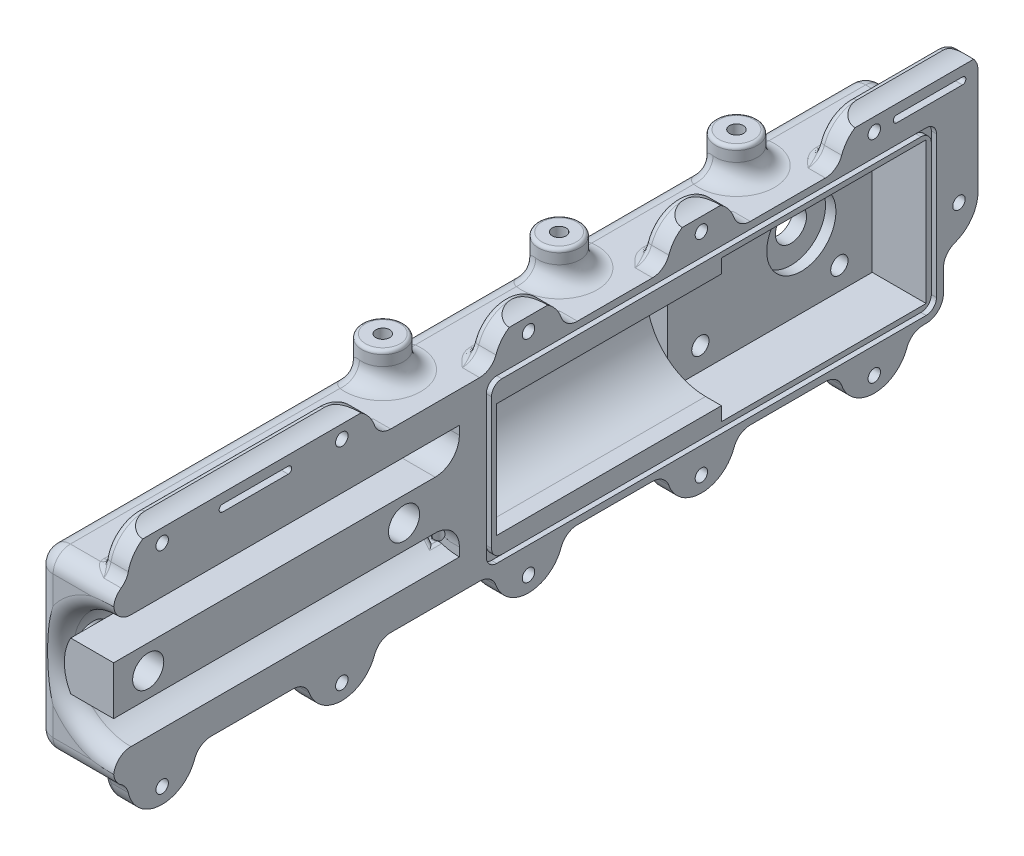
SolidWorks part; units mm, degrees
ref_plane "Plan de face" through (0, 0, 0) normal (0, 0, 1) x (1, 0, 0)
ref_plane "Plan de dessus" through (0, 0, 0) normal (0, 1, 0) x (1, 0, 0)
ref_plane "Plan de droite" through (0, 0, 0) normal (1, 0, 0) x (0, 0, -1)
sketch "Esquisse1" plane through (0, 0, 0) normal (1, 0, 0) x (0, 0, -1)
  line L5 (0, 0) -> (-240, 0)
  line L6 (0, 0) -> (0, 51)
  line L7 (0, 51) -> (-240, 51)
  line L8 (-240, 0) -> (-240, 51)
  dimension "D3" = 51
  dimension "D4" = 240
extrude "Boss.-Extru.2" add sketch "Esquisse1" along normal blind 22.5
sketch "Esquisse2" plane through (0, 0, 0) normal (-1, 0, 0) x (0, 0, 1)
  line L0 (0, 0) -> (0, 51) construction
  line L1 (5, 46) -> (64.2, 46)
  line L2 (5, 46) -> (5, 5)
  line L3 (5, 5) -> (64.2, 5)
  line L4 (64.2, 46) -> (64.2, 5)
  point P6 (5, 25.5)
  point P7 (0, 25.5)
  dimension "D1" = 41
  dimension "D2" = 59.2
  dimension "D3" = 5
extrude "Enlèv. mat.-Extru.1" cut sketch "Esquisse2" against normal blind 15.6
sketch "Esquisse3" plane through (0, 0, 0) normal (-1, 0, 0) x (0, 0, 1)
  line L0 (64.2, 5) -> (64.2, 46) construction
  line L1 (129.2, 42) -> (64.2, 42)
  line L2 (129.2, 42) -> (129.2, 9)
  line L3 (129.2, 9) -> (64.2, 9)
  line L4 (64.2, 42) -> (64.2, 9)
  point P7 (64.2, 25.5)
  point P8 (64.2, 25.5)
  dimension "D1" = 33
  dimension "D2" = 65
extrude "Enlèv. mat.-Extru.2" cut sketch "Esquisse3" against normal blind 21.6
fillet "Congé1" radius 17 2 edges at (21.6, 9, 96.7) (21.6, 42, 96.7)
sketch "Esquisse4" plane through (15.6, 0, 0) normal (-1, 0, 0) x (0, 0, 1)
  line L0 (5, 46) -> (5, 5) construction
  line L1 (64.2, 46) -> (5, 46) construction
  circle A0 centre (14.5, 39.5) radius 2.5
  circle A1 centre (54.7, 39.5) radius 2.5
  circle A2 centre (54.7, 11.5) radius 2.5
  circle A3 centre (14.5, 11.5) radius 2.5
  dimension "D3" = 5
  dimension "D1" = 40.2
  dimension "D2" = 28
  dimension "D4" = 9.5
  dimension "D5" = 6.5
extrude "Enlèv. mat.-Extru.4" cut sketch "Esquisse4" against normal through all
sketch "Esquisse5" plane through (15.6, 0, 0) normal (-1, 0, 0) x (0, 0, 1)
  line L0 (5, 46) -> (5, 5) construction
  line L1 (5, 46) -> (5, 5) construction
  circle A0 centre (25.5, 25.5) radius 10
  point P7 (5, 25.5)
  dimension "D1" = 20
  dimension "D2" = 20.5
extrude "Enlèv. mat.-Extru.5" cut sketch "Esquisse5" against normal blind 3
sketch "Esquisse6" plane through (18.6, 0, 0) normal (-1, 0, 0) x (0, 0, 1)
  circle A0 centre (25.5, 25.5) radius 4.5
  circle A1 centre (25.5, 25.5) radius 10 construction
  dimension "D1" = 9
extrude "Enlèv. mat.-Extru.6" cut sketch "Esquisse6" against normal through all
sketch "Esquisse7" plane through (0, 0, 240) normal (0, 0, 1) x (1, 0, 0)
  line L0 (0, 51) -> (0, 0) construction
  circle A0 centre (0, 25.5) radius 14.25
  circle A1 centre (0, 25.5) radius 16.5
  dimension "D1" = 28.5
  dimension "D2" = 33
extrude "Enlèv. mat.-Extru.7" cut sketch "Esquisse7" against normal blind 100
sketch "Esquisse8" plane through (22.5, 0, 0) normal (1, 0, 0) x (0, 0, -1)
  line L0 (-240, 51) -> (-240, 0) construction
  circle A0 centre (-230, 25.5) radius 4.5
  circle A1 centre (-156, 25.5) radius 4.5
  point P7 (-240, 25.5)
  dimension "D1" = 9
  dimension "D2" = 74
  dimension "D3" = 10
extrude "Enlèv. mat.-Extru.8" cut sketch "Esquisse8" against normal through all
sketch "Esquisse9" plane through (0, 0, 240) normal (0, 0, 1) x (1, 0, 0)
  line L0 (-0.9801, 40.4) -> (-0.9801, 32.5)
  line L1 (-0.9801, 32.5) -> (13.7913, 32.5)
  line L2 (-0.9801, 10.6) -> (-0.9801, 18.5)
  line L4 (-0.9801, 18.5) -> (13.7913, 18.5)
  spline S0 degree 3 poles (-0.9801, 40.4) (1.9842, 40.2871) (8.4104, 40.1159) (12.8329, 35.266) (13.7913, 32.5) knots 0 0 0 0 0.512203 1 1 1 1
  spline S2 degree 3 poles (-0.9801, 10.6) (1.902, 10.0791) (8.428, 10.7944) (12.2618, 16.0303) (13.7913, 18.5) knots 0 0 0 0 0.497728 1 1 1 1
  dimension "D3" = 1.6
  dimension "D1" = 14
  dimension "D2" = 1.6
extrude "Enlèv. mat.-Extru.9" cut sketch "Esquisse9" against normal up to surface (100 mm away)
fillet "Congé2" radius 7 2 edges at (6.2061, 18.5, 140) (6.2061, 32.5, 140)
sketch "Esquisse10" plane through (0, 0, 0) normal (-1, 0, 0) x (0, 0, 1)
  line L0 (0, 0) -> (0, 51) construction
  line L1 (0, 51) -> (240, 51) construction
  line L2 (240, 0) -> (0, 0) construction
  line L3 (0, 35.5) -> (0, 15.5)
  line L4 (10, 51) -> (30, 51)
  line L5 (110, 51) -> (130, 51)
  line L6 (216, 51) -> (236, 51)
  line L7 (236, 0) -> (216, 0)
  line L8 (130, 0) -> (110, 0)
  line L9 (30, 0) -> (10, 0)
  line L10 (60, 51) -> (80, 51)
  line L11 (60, 0) -> (80, 0)
  line L12 (164, 0) -> (184, 0)
  line L13 (164, 51) -> (184, 51)
  arc A0 (0, 35.5) -> (0, 15.5) centre (0, 25.5) ccw
  arc A1 (130, 51) -> (110, 51) centre (120, 51) ccw
  arc A2 (130, 0) -> (110, 0) centre (120, 0) cw
  arc A3 (30, 51) -> (10, 51) centre (20, 51) ccw
  arc A4 (30, 0) -> (10, 0) centre (20, 0) cw
  arc A5 (236, 51) -> (216, 51) centre (226, 51) ccw
  arc A6 (236, 0) -> (216, 0) centre (226, 0) cw
  arc A7 (80, 51) -> (60, 51) centre (70, 51) ccw
  arc A8 (80, 0) -> (60, 0) centre (70, 0) cw
  arc A9 (184, 51) -> (164, 51) centre (174, 51) ccw
  arc A10 (184, 0) -> (164, 0) centre (174, 0) cw
  dimension "D5" = 10
  dimension "D1" = 100
  dimension "D2" = 106
  dimension "D3" = 50
  dimension "D4" = 54
extrude "Boss.-Extru.3" add sketch "Esquisse10" against normal blind 7
fillet "Congé3" radius 5 31 edges at (11.25, 51, 240) (22.5, 25.5, 240) (11.25, 0, 240) (16.5, 25.5, 240) (3.5, 0, 130) (3.5, 0, 110) (3.5, 0, 164) (3.5, 0, 184) (3.5, 0, 236) (3.5, 0, 216) (3.5, 0, 80) (3.5, 0, 60) (3.5, 0, 30) (3.5, 0, 10) (3.5, 51, 184) (3.5, 51, 164) (3.5, 51, 110) (3.5, 51, 130) (3.5, 51, 60) (3.5, 51, 80) (3.5, 51, 10) (3.5, 51, 30) (3.5, 51, 236) (3.5, 51, 216) (3.5, 35.5, 0) (3.5, 15.5, 0) (22.5, 0, 120) (11.25, 0, 0) (22.5, 51, 120) (22.5, 25.5, 0) (11.25, 51, 0)
fillet "Congé4" radius 5 2 edges at (3.5, 50.8991, 235.9995) (3.5, 0.1009, 235.9995)
fillet "Congé5" radius 2 28 edges at (7, 51.9175, 58.7446) (7, 51, 70) (7, 51.9175, 81.2554) (7, 61, 70) (7, 51.9175, 108.7446) (7, 51, 120) (7, 51.9175, 131.2554) (7, 61, 120) (7, -0.4534, 236.5017) (7, 0, 223.4289) (7, -0.9175, 214.7446) (7, -9.9817, 226.6047) (7, -0.9175, 185.2554) (7, 0, 174) (7, -0.9175, 162.7446) (7, -10, 174) (7, -0.9175, 131.2554) (7, 0, 120) (7, -0.9175, 108.7446) (7, -10, 120) (7, -0.9175, 81.2554) (7, 0, 70) (7, -0.9175, 58.7446) (7, -10, 70) (7, -0.9175, 31.2554) (7, 0, 20) (7, -0.9175, 8.7446) (7, -10, 20)
sketch "Esquisse11" plane through (22.5, 0, 0) normal (1, 0, 0) x (0, 0, -1)
  circle A0 centre (-54.7, 39.5) radius 5
  circle A1 centre (-14.5, 39.5) radius 5
  circle A2 centre (-14.5, 11.5) radius 5
  circle A3 centre (-54.7, 11.5) radius 5
  dimension "D1" = 10
extrude "Enlèv. mat.-Extru.10" cut sketch "Esquisse11" against normal blind 3
mirror "Symétrie1" about plane through (0, 0, 0) normal (1, 0, 0) of "Enlèv. mat.-Extru.10", "Congé5", "Congé4", "Congé3", "Boss.-Extru.3", "Congé2", "Enlèv. mat.-Extru.9", "Enlèv. mat.-Extru.8", "Enlèv. mat.-Extru.7", "Enlèv. mat.-Extru.6", "Enlèv. mat.-Extru.5", "Enlèv. mat.-Extru.4", "Congé1", "Enlèv. mat.-Extru.1", "Enlèv. mat.-Extru.2", "Boss.-Extru.2"
sketch "Esquisse12" plane through (0, 0, 0) normal (1, 0, 0) x (0, 0, -1)
  line L1 (-247.0268, 61.9911) -> (12.212, 61.9911)
  line L2 (-247.0268, 61.9911) -> (-247.0268, -12.2581)
  line L3 (-247.0268, -12.2581) -> (12.212, -12.2581)
  line L4 (12.212, 61.9911) -> (12.212, -12.2581)
extrude "Enlèv. mat.-Extru.11" cut sketch "Esquisse12" along normal blind 37
sketch "Esquisse13" plane through (-7, 0, 0) normal (-1, 0, 0) x (0, 0, 1)
  line L2 (27.8176, -2) -> (12.1824, -2) construction
  line L3 (62.1824, 53) -> (77.8176, 53) construction
  line L4 (112.1824, 53) -> (127.8176, 53) construction
  line L5 (5.8579, 51) -> (34.1421, 51) construction
  line L8 (0, 11.3579) -> (0, 39.6421) construction
  line L9 (181.8176, -2) -> (166.1824, -2) construction
  line L10 (233.746, -2) -> (218.1824, -2) construction
  circle A0 centre (225.9642, 55.5) radius 1.8
  circle A1 centre (174, 55.5) radius 1.8
  circle A2 centre (225.9642, -5.5) radius 1.8
  circle A3 centre (174, -5.5) radius 1.8
  circle A4 centre (120, -5.5) radius 1.8
  circle A5 centre (120, 55.5) radius 1.8
  circle A6 centre (70, 55.5) radius 1.8
  circle A7 centre (70, -5.5) radius 1.8
  circle A8 centre (20, -5.5) radius 1.8
  circle A9 centre (20, 55.5) radius 1.8
  circle A10 centre (-4.5, 25.5) radius 1.8
  point P37 (70, 53)
  point P41 (120, 53)
  point P45 (0, 25.5)
  point P54 (20, 51)
  point P63 (174, -2)
  point P68 (225.9642, -2)
  dimension "D1" = 3.6
  dimension "D2" = 4.5
  dimension "D3" = 4.5
  dimension "D4" = 3.5
extrude "Enlèv. mat.-Extru.12" cut sketch "Esquisse13" against normal blind 8
chamfer "Chanfrein1" distance 2.6 angle 45 11 edges at (-7, -5.5, 121.8) (-7, -5.5, 175.8) (-7, -5.5, 227.7642) (-7, 55.5, 227.7642) (-7, 55.5, 175.8) (-7, 55.5, 121.8) (-7, 55.5, 71.8) (-7, -5.5, 71.8) (-7, -5.5, 21.8) (-7, 25.5, -2.7) (-7, 55.5, 21.8)
sketch "Esquisse14" plane through (0, 0, 0) normal (1, 0, 0) x (0, 0, -1)
  line L0 (-5, 46) -> (-5, 5) construction
  line L1 (-6.5, 47.5) -> (-127.7, 47.5)
  line L2 (-3.5, 44.5) -> (-3.5, 6.5)
  line L3 (-6.5, 3.5) -> (-127.7, 3.5)
  line L4 (-130.7, 44.5) -> (-130.7, 6.5)
  line L5 (-5, 49) -> (-129.2, 49)
  line L6 (-2, 46) -> (-2, 5)
  line L7 (-5, 2) -> (-129.2, 2)
  line L8 (-132.2, 46) -> (-132.2, 5)
  line L9 (-64.2, 46) -> (-5, 46) construction
  line L10 (-5, 5) -> (-64.2, 5) construction
  line L11 (-129.2, 9) -> (-129.2, 42) construction
  arc A0 (-127.7, 47.5) -> (-130.7, 44.5) centre (-127.7, 44.5) ccw
  arc A1 (-129.2, 49) -> (-132.2, 46) centre (-129.2, 46) ccw
  arc A2 (-5, 49) -> (-2, 46) centre (-5, 46) cw
  arc A3 (-6.5, 47.5) -> (-3.5, 44.5) centre (-6.5, 44.5) cw
  arc A4 (-2, 5) -> (-5, 2) centre (-5, 5) cw
  arc A5 (-129.2, 2) -> (-132.2, 5) centre (-129.2, 5) cw
  arc A6 (-127.7, 3.5) -> (-130.7, 6.5) centre (-127.7, 6.5) cw
  arc A7 (-3.5, 6.5) -> (-6.5, 3.5) centre (-6.5, 6.5) cw
  dimension "D9" = 3
  dimension "D1" = 1.5
  dimension "D2" = 1.5
  dimension "D3" = 1.5
  dimension "D4" = 1.5
  dimension "D5" = 1.5
  dimension "D6" = 1.5
  dimension "D7" = 1.5
  dimension "D8" = 1.5
extrude "Enlèv. mat.-Extru.13" cut sketch "Esquisse14" against normal blind 1.5
sketch "Esquisse15" plane through (0, 0, 129.2) normal (0, 0, -1) x (-1, 0, 0)
  line L0 (0, 9) -> (0, 42) construction
  circle A0 centre (8, 13.4525) radius 4
  arc A1 (4.6, 9) -> (21.5926, 25.5) centre (4.6, 26) ccw construction
  dimension "D1" = 8
  dimension "D2" = 8
extrude "Enlèv. mat.-Extru.14" cut sketch "Esquisse15" against normal up to surface (14.1165 mm away)
sketch "Esquisse16" plane through (0, 0, 0) normal (0, -1, 0) x (1, 0, 0)
  line L0 (-8, 137.1421) -> (-5, 137.1421) construction
  line L1 (-8, 139.1421) -> (-5, 139.1421)
  line L2 (-8, 135.1421) -> (-5, 135.1421)
  line L3 (0, 159.8579) -> (0, 134.1421) construction
  line L4 (-5, 134.1421) -> (0, 134.1421) construction
  arc A0 (-8, 139.1421) -> (-8, 135.1421) centre (-8, 137.1421) ccw
  arc A1 (-5, 135.1421) -> (-5, 139.1421) centre (-5, 137.1421) ccw
  point P2 (-6.5, 137.1421)
  dimension "D1" = 4
  dimension "D2" = 3
  dimension "D3" = 5
  dimension "D4" = 3
extrude "Enlèv. mat.-Extru.15" cut sketch "Esquisse16" against normal blind 14
fillet "Congé7" radius 3 1 edges at (-8, 17.4525, 129.2)
fillet "Congé8" radius 1 5 edges at (-4.0269, 12.9896, 138.8894) (-6.3542, 9.8067, 139.1421) (-4.4338, 11.6408, 135.2239) (-9.9958, 9.986, 137.0125) (-6.3542, 9.8067, 135.1421)
fillet "Congé9" radius 2 1 edges at (-9.4073, 11.9445, 140.0141)
fillet "Congé10" radius 2 5 edges at (-11.9445, 14.1167, 141.0777) (-11.5617, 15.273, 140) (-5.8575, 10.0747, 141.6907) (-11.2285, 11.091, 140.0441)
fillet "Congé12" radius 2 1 edges at (-10.8487, 16.2605, 139.934)
fillet "Congé13" radius 3 4 edges at (-3, 0, 137.1421) (-6.5, 0, 135.1421) (-10, 0, 137.1421) (-6.5, 0, 139.1421)
sketch "Esquisse17" plane through (0, 0, 0) normal (1, 0, 0) x (0, 0, -1)
  line L0 (-20, 61) -> (5, 61)
  line L1 (10, 56) -> (10, 25.5)
  line L2 (-226, 61) -> (-174, 61)
  line L4 (-186.6196, 50.2394) -> (-214.9858, 50.2394)
  arc A0 (-10.5719, 54.3333) -> (-29.4281, 54.3333) centre (-20, 51) ccw construction
  arc A1 (3.3333, 16.0719) -> (3.3333, 34.9281) centre (0, 25.5) ccw construction
  arc A2 (5, 61) -> (10, 56) centre (5, 56) cw
  arc A3 (-216.5719, 54.3333) -> (-235.7615, 53.1708) centre (-226, 51) ccw construction
  arc A4 (-164.5719, 54.3333) -> (-183.4281, 54.3333) centre (-174, 51) ccw construction
  spline S0 degree 3 poles (-20, 61) (-16.1428, 60.3069) (-13.4752, 55.9771) (-8.98, 49.1011) (-3.9795, 50.6024) (-1.1696, 48.1815) (-0.8201, 44.4832) (-1.0493, 40.3481) (-1.1061, 34.1768) (6.4652, 32.9411) (9.145, 28.4288) (10, 25.5) knots 0 0 0 0 0.195875 0.325509 0.406332 0.460765 0.518553 0.614083 0.720859 0.81792 1 1 1 1
  spline S1 degree 3 poles (-186.6196, 50.2394) (-184.2368, 50.739) (-182.9647, 53.5446) (-181.2911, 56.952) (-179.3207, 58.425) (-177.1202, 60.2541) (-174.6558, 59.8002) (-174, 61) knots 0 0 0 0 0.365291 0.514478 0.649539 0.78704 1 1 1 1
  spline S2 degree 3 poles (-214.9858, 50.2394) (-216.7319, 51.7727) (-217.2581, 55.0501) (-219.8033, 58.1898) (-222.3624, 60.3706) (-225.1716, 59.7078) (-226, 61) knots 0 0 0 0 0.407206 0.572661 0.743026 1 1 1 1
  dimension "D1" = 5
extrude "Boss.-Extru.5" add sketch "Esquisse17" against normal up to surface (7 mm away)
sketch "Esquisse18" plane through (0, 0, 0) normal (1, 0, 0) x (0, 0, -1)
  line L0 (-13.5, 55.5) -> (5.5, 55.5) construction
  line L1 (-13.5, 56.5) -> (5.5, 56.5)
  line L2 (-13.5, 54.5) -> (5.5, 54.5)
  line L3 (-208.5, 55.5) -> (-189.5, 55.5) construction
  line L4 (-208.5, 56.5) -> (-189.5, 56.5)
  line L5 (-208.5, 54.5) -> (-189.5, 54.5)
  line L6 (10, 25.5) -> (10, 56) construction
  line L7 (5, 61) -> (-20, 61) construction
  arc A0 (-13.5, 56.5) -> (-13.5, 54.5) centre (-13.5, 55.5) ccw
  arc A1 (5.5, 54.5) -> (5.5, 56.5) centre (5.5, 55.5) ccw
  arc A2 (-208.5, 56.5) -> (-208.5, 54.5) centre (-208.5, 55.5) ccw
  arc A3 (-189.5, 54.5) -> (-189.5, 56.5) centre (-189.5, 55.5) ccw
  circle A5 centre (-174, 55.5) radius 1.8 construction
  point P2 (-4, 55.5)
  point P7 (-199, 55.5)
  dimension "D1" = 2
  dimension "D2" = 19
  dimension "D3" = 2
  dimension "D4" = 19
  dimension "D5" = 4.5
  dimension "D6" = 5.5
  dimension "D7" = 25
extrude "Enlèv. mat.-Extru.16" cut sketch "Esquisse18" against normal blind 7
fillet "Congé14" radius 2 17 edges at (-7, 28.6789, 0) (-7, 51, 19.5711) (-7, 51, 197.4289) (-7, 59.165, 25.7735) (-7, 50.7771, 236.4764) (-7, 51.9175, 31.2554) (-7, 51.9175, 162.7446) (-7, 14.2446, -0.9175) (-7, 58.8009, 232.2567) (-7, 51.4534, 236.5017) (-7, 19.7265, -8.165) (-7, 49.5355, 1.4645) (-7, 61, 7.5) (-7, 59.5355, -8.5355) (-7, 40.75, -10) (-7, 59.165, 168.2265) (-7, 61, 200)
sketch "Esquisse19" plane through (0, 0, -10) normal (0, 0, -1) x (-1, 0, 0)
  circle A0 centre (0, 67.5622) radius 8.25
  dimension "D1" = 16.5
extrude "Enlèv. mat.-Extru.17" cut sketch "Esquisse19" against normal up to surface (250 mm away)
sketch "Esquisse20" plane through (0, 51, 0) normal (0, 1, 0) x (1, 0, 0)
  line L0 (0, -34.1421) -> (0, -55.8579) construction
  line L1 (-5, -55.8579) -> (0, -55.8579) construction
  line L2 (0, -134.1421) -> (-5, -134.1421) construction
  circle A0 centre (-16, -43.8579) radius 6
  circle A1 centre (-16, -95.1421) radius 6
  circle A2 centre (-16, -146.1421) radius 6
  dimension "D2" = 12
  dimension "D1" = 16
  dimension "D3" = 12
  dimension "D4" = 51
  dimension "D5" = 12
extrude "Boss.-Extru.6" add sketch "Esquisse20" along normal blind 9
sketch "Esquisse21" plane through (0, 60, 0) normal (0, 1, 0) x (1, 0, 0)
  circle A0 centre (-16, -146.1421) radius 6
  circle A1 centre (-16, -95.1421) radius 6
  circle A2 centre (-16, -43.8579) radius 6
extrude "Boss.-Extru.7" add sketch "Esquisse21" against normal blind 13
fillet "Congé15" radius 5 6 edges at (-21.9245, 48.3289, 42.909) (-10, 51, 43.8579) (-21.9245, 48.3289, 94.1933) (-10, 51, 95.1421) (-21.9941, 48.1915, 145.8771) (-10, 51, 146.1421)
fillet "Congé16" radius 1 3 edges at (-16, 60, 152.1421) (-16, 60, 101.1421) (-16, 60, 49.8579)
sketch "Esquisse22" plane through (0, 60, 0) normal (0, 1, 0) x (1, 0, 0)
  circle A0 centre (-16, -43.8579) radius 2
  circle A1 centre (-16, -95.1421) radius 2
  circle A2 centre (-16, -146.1421) radius 2
  dimension "D1" = 4
extrude "Enlèv. mat.-Extru.18" cut sketch "Esquisse22" against normal blind 8
